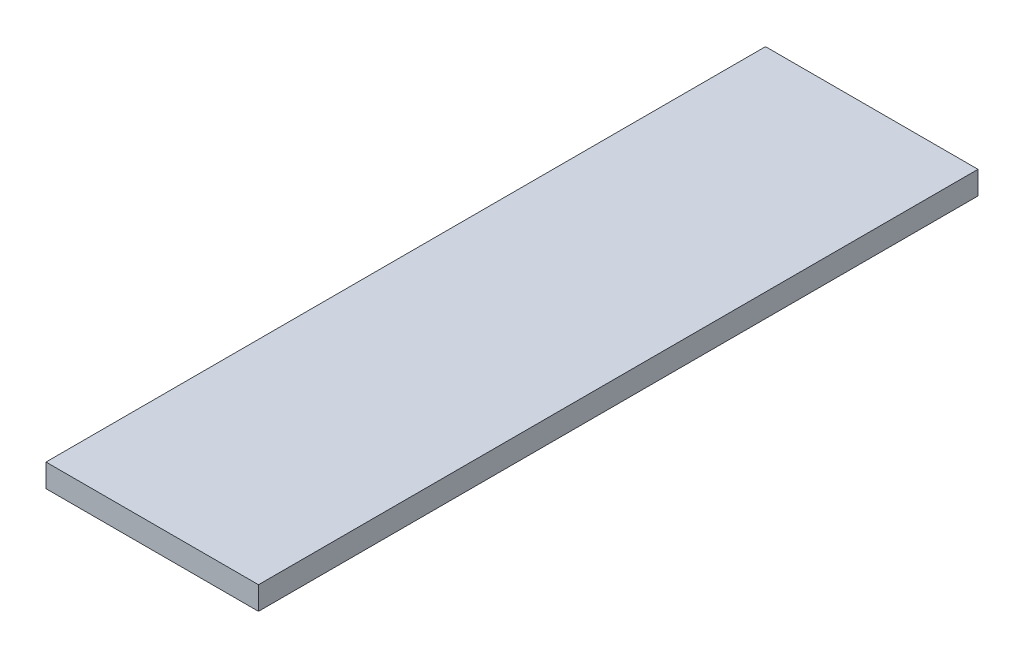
SolidWorks part; units mm, degrees
ref_plane "Front Plane" through (0, 0, 0) normal (0, 0, 1) x (1, 0, 0)
ref_plane "Top Plane" through (0, 0, 0) normal (0, 1, 0) x (1, 0, 0)
ref_plane "Right Plane" through (0, 0, 0) normal (1, 0, 0) x (0, 0, -1)
sketch "Sketch1" plane through (0, 0, 0) normal (0, 1, 0) x (1, 0, 0)
  line L1 (-584.2, 1978.0707) -> (584.2, 1978.0707)
  line L2 (-584.2, 1978.0707) -> (-584.2, -1978.0707)
  line L3 (-584.2, -1978.0707) -> (584.2, -1978.0707)
  line L4 (584.2, 1978.0707) -> (584.2, -1978.0707)
  line L5 (-584.2, 1978.0707) -> (584.2, -1978.0707) construction
  line L6 (-584.2, -1978.0707) -> (584.2, 1978.0707) construction
  point P0 (0, 0)
  dimension "D1" = 1168.4
  dimension "D2" = 3956.1414
extrude "Boss-Extrude1" add sketch "Sketch1" along normal blind 127
